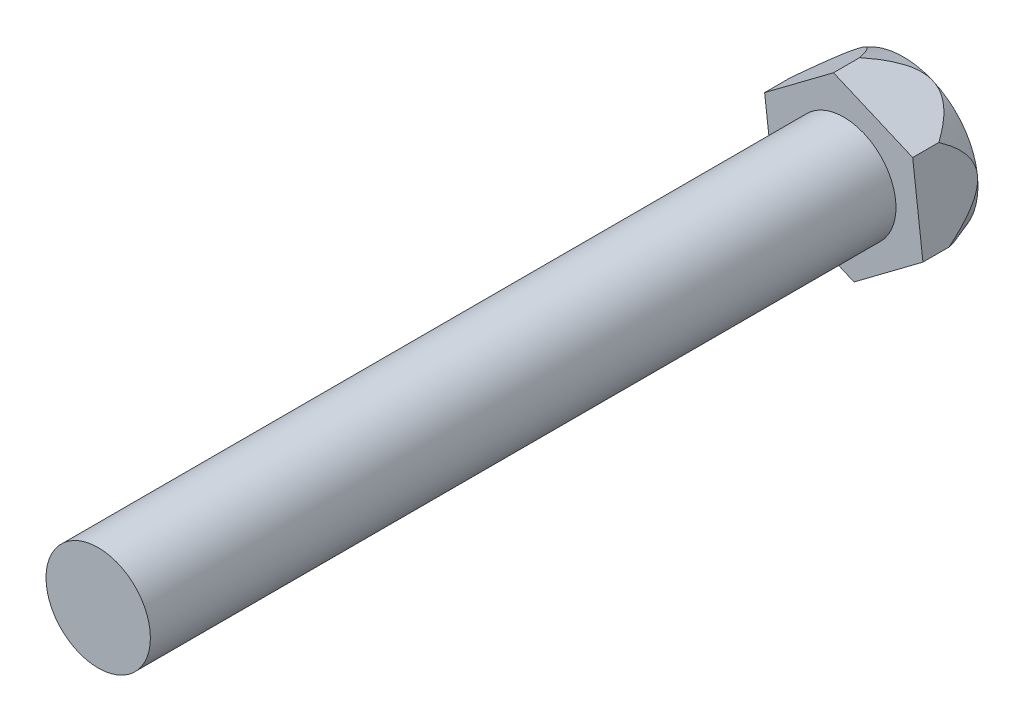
SolidWorks part; units mm, degrees
ref_plane "Front Plane" through (0, 0, 0) normal (0, 0, 1) x (1, 0, 0)
ref_plane "Top Plane" through (0, 0, 0) normal (0, 1, 0) x (1, 0, 0)
ref_plane "Right Plane" through (0, 0, 0) normal (1, 0, 0) x (0, 0, -1)
sketch "Sketch10" plane through (0, 0, 0) normal (0, 0, 1) x (1, 0, 0)
  circle A0 centre (0, 0) radius 1.75
  dimension "D1" = 3.5
extrude "Boss-Extrude1" add sketch "Sketch10" along normal blind 25
sketch "Sketch11" plane through (0, 0, 0) normal (0, 0, -1) x (-1, 0, 0)
  circle A0 centre (0, 0) radius 1.75
sketch "Sketch13" plane through (0, 0, 0) normal (0, 0, -1) x (-1, 0, 0)
  line L1 (0.3444, 2.8661) -> (-2.31, 1.7313)
  line L2 (-2.31, 1.7313) -> (-2.6543, -1.1348)
  line L3 (-2.6543, -1.1348) -> (-0.3444, -2.8661)
  line L4 (-0.3444, -2.8661) -> (2.31, -1.7313)
  line L5 (2.31, -1.7313) -> (2.6543, 1.1348)
  line L6 (2.6543, 1.1348) -> (0.3444, 2.8661)
  circle A0 centre (0, 0) radius 2.5 construction
extrude "Boss-Extrude2" add sketch "Sketch13" along normal blind 2
sketch "Sketch14" plane through (0, 0, -2) normal (0, 0, -1) x (-1, 0, 0)
  circle A0 centre (0, 0) radius 2.5
extrude "Cut-Extrude1" cut sketch "Sketch14" against normal blind 2 draft 19 flip side to cut
